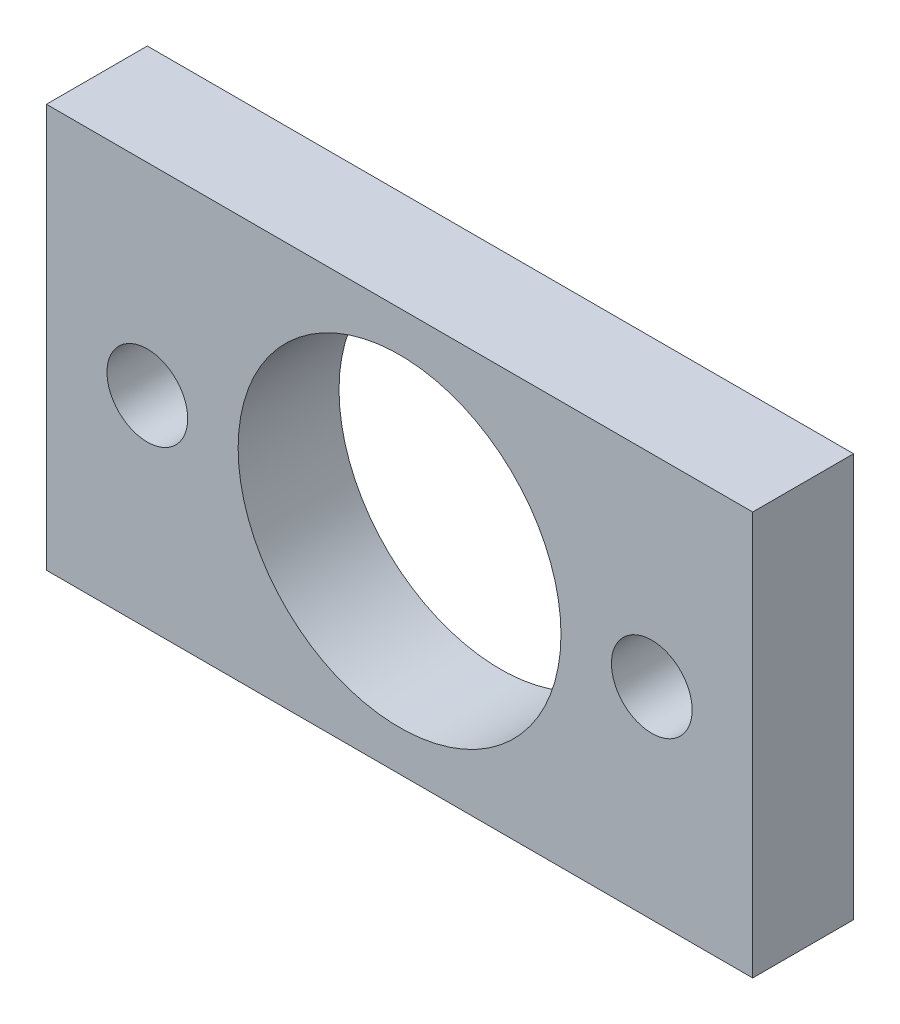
SolidWorks part; units mm, degrees
ref_plane "Alzado" through (0, 0, 0) normal (0, 0, 1) x (1, 0, 0)
ref_plane "Planta" through (0, 0, 0) normal (0, 1, 0) x (1, 0, 0)
ref_plane "Vista lateral" through (0, 0, 0) normal (1, 0, 0) x (0, 0, -1)
sketch "Croquis1" plane through (0, 0, 0) normal (0, 0, 1) x (1, 0, 0)
  line L1 (-35, 20) -> (35, 20)
  line L2 (-35, 20) -> (-35, -20)
  line L3 (-35, -20) -> (35, -20)
  line L4 (35, 20) -> (35, -20)
  circle A0 centre (0, 0) radius 16
  circle A1 centre (-25, 0) radius 4
  circle A2 centre (25, 0) radius 4
extrude "Extruir1" add sketch "Croquis1" along normal blind 10
